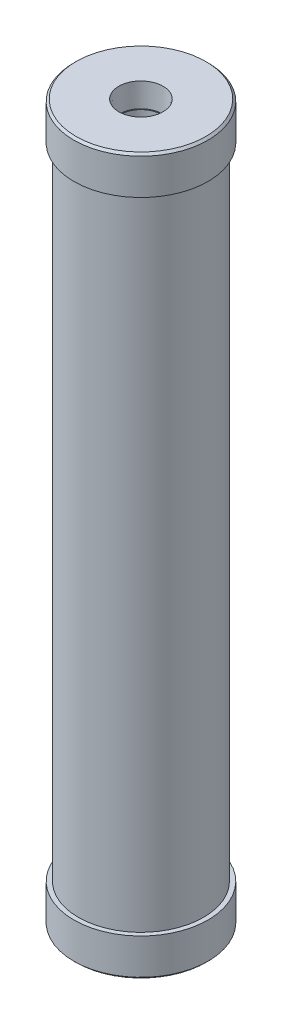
SolidWorks part; units mm, degrees
ref_plane "Front Plane" through (0, 0, 0) normal (0, 0, 1) x (1, 0, 0)
ref_plane "Top Plane" through (0, 0, 0) normal (0, 1, 0) x (1, 0, 0)
ref_plane "Right Plane" through (0, 0, 0) normal (1, 0, 0) x (0, 0, -1)
sketch "Sketch1" plane through (0, 0, 0) normal (0, 1, 0) x (1, 0, 0)
  circle A0 centre (0, 0) radius 44.45
  circle A1 centre (0, 0) radius 38.6334
  dimension "D1" = 88.9
  dimension "D2" = 5.8166
extrude "Boss-Extrude1" add sketch "Sketch1" along normal blind 508
ref_plane "Plane1" through (0, 508, 0) normal (0, 1, 0) x (1, 0, 0)
sketch "Sketch2" plane through (0, 0, 0) normal (0, 1, 0) x (1, 0, 0)
  circle A0 centre (0, 0) radius 47.625
  dimension "D1" = 95.25
extrude "Boss-Extrude2" add sketch "Sketch2" along normal blind 26.924
hole_wizard "1 NPT Tapped Hole1" positions "Sketch4" profile "Sketch3" size "1" standard "ANSI Inch"
sketch "Sketch4" plane through (0, 0, 0) normal (0, 1, 0) x (1, 0, 0)
  point P0 (0, 0)
sketch "Sketch3" plane through (0, 0, 0) normal (1, 0, 0) x (0, 0, -1)
  line L0 (0, 0) -> (0, 36.6469)
  line L1 (14.4907, 27.94) -> (0, 36.6469)
  line L2 (-14.4907, 27.94) -> (0, 36.6469) construction
  line L3 (14.4907, 27.94) -> (14.4907, 16.764)
  line L4 (14.4907, 16.764) -> (15.228, 16.764)
  line L5 (15.228, 16.764) -> (15.7299, 0)
  line L6 (-15.228, 16.764) -> (-15.7299, 0) construction
  line L7 (15.7299, 0) -> (0, 0)
  line L8 (0, -6.35) -> (0, 107.95) construction
  line L11 (-14.4907, 16.764) -> (-15.228, 16.764) construction
  dimension "Tap Drill Dia." = 28.9814
  dimension "Tap Drill Depth" = 27.94
  dimension "Thread Dia." = 31.4598
  dimension "Thread Angle" = 3.43
  dimension "Thread Depth" = 16.764
  dimension "Drill Angle" = 118
sketch "Sketch5" plane through (0, 508, 0) normal (0, 1, 0) x (1, 0, 0)
  circle A0 centre (0, 0) radius 47.625
  dimension "D1" = 95.25
extrude "Boss-Extrude3" add sketch "Sketch5" against normal blind 26.924
hole_wizard "1 NPT Tapped Hole2" positions "Sketch7" profile "Sketch6" size "1" standard "ANSI Inch"
sketch "Sketch7" plane through (0, 508, 0) normal (0, 1, 0) x (1, 0, 0)
  point P0 (0, 0)
sketch "Sketch6" plane through (0, 508, 0) normal (1, 0, 0) x (0, 0, 1)
  line L0 (0, 0) -> (0, 36.6469)
  line L1 (14.4907, 27.94) -> (0, 36.6469)
  line L2 (-14.4907, 27.94) -> (0, 36.6469) construction
  line L3 (14.4907, 27.94) -> (14.4907, 16.764)
  line L4 (14.4907, 16.764) -> (15.228, 16.764)
  line L5 (15.228, 16.764) -> (15.7299, 0)
  line L6 (-15.228, 16.764) -> (-15.7299, 0) construction
  line L7 (15.7299, 0) -> (0, 0)
  line L8 (0, -6.35) -> (0, 107.95) construction
  line L11 (-14.4907, 16.764) -> (-15.228, 16.764) construction
  dimension "Tap Drill Dia." = 28.9814
  dimension "Tap Drill Depth" = 27.94
  dimension "Thread Dia." = 31.4598
  dimension "Thread Angle" = 3.43
  dimension "Thread Depth" = 16.764
  dimension "Drill Angle" = 118
chamfer "Chamfer1" distance 1.524 angle 45 2 edges at (0, 0, 47.625) (0, 508, 47.625)
